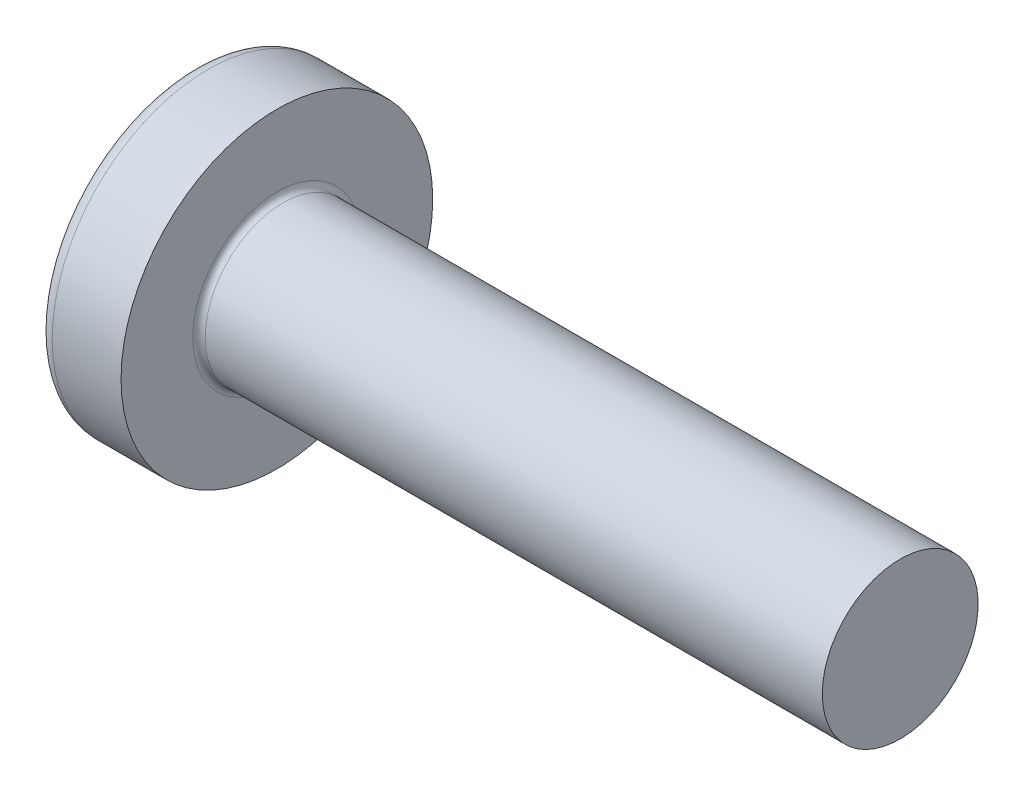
SolidWorks part; units mm, degrees
ref_plane "Plane1" through (0, 0, 0) normal (0, 0, 1) x (1, 0, 0)
ref_plane "Plane2" through (0, 0, 0) normal (0, 1, 0) x (1, 0, 0)
ref_plane "Plane3" through (0, 0, 0) normal (1, 0, 0) x (0, 0, -1)
sketch "BodySke" plane through (0, 0, 0) normal (0, 0, 1) x (1, 0, 0)
  line L0 (2.1, 1.25) -> (2.1, 2.5)
  line L1 (2.325, 6.35) -> (2.325, -3.175) construction
  line L2 (-25.4, 0) -> (127, 0) construction
  line L3 (12.1, 0) -> (0, 0)
  line L4 (2.1, 1.25) -> (12.1, 1.25)
  line L5 (12.1, 1.25) -> (12.1, 0)
  line L6 (0.995, 2.5) -> (2.1, 2.5)
  line L8 (2.1, 6.35) -> (2.1, -3.175) construction
  arc A0 (0.8032, 2.4043) -> (0, 0) centre (4, 0) ccw
  arc A2 (0.8032, 2.4043) -> (0.995, 2.5) centre (0.995, 2.26) cw
revolve "Base-Revolve" add sketch "BodySke"
fillet "Fillet1" radius 0.1 1 edges at (2.1, 0, 1.25)
sketch "Sketch3" plane through (0, 0, 0) normal (1, 0, 0) x (0, 0, -1)
  line L0 (0.37, -1.3) -> (-0.37, -1.3)
  line L1 (0.37, -1.3) -> (0.37, 1.3)
  line L2 (-0.37, 1.3) -> (0.37, 1.3)
  line L3 (-0.37, 1.3) -> (-0.37, -1.3)
ref_plane "Plane4" through (1.5, 0, 0) normal (1, 0, 0) x (0, 0, -1)
sketch "Sketch4" plane through (1.5, 0, 0) normal (1, 0, 0) x (0, 0, -1)
  line L0 (0.37, -0.5521) -> (-0.37, -0.5521)
  line L1 (0.37, -0.5521) -> (0.37, 0.5521)
  line L2 (-0.37, 0.5521) -> (0.37, 0.5521)
  line L3 (-0.37, 0.5521) -> (-0.37, -0.5521)
loft "Recess" cut profiles "Sketch3", "Sketch4"
pattern_circular "RecPat" count 2 every 90 about axis through (0, 0, 0) along (1, 0, 0) of "Recess"
sketch "RecCorSke" plane through (0, 0, 0) normal (0, 0, 1) x (1, 0, 0)
  line L0 (-3.175, 0) -> (15.875, 0) construction
  line L1 (-25.4, 0) -> (127, 0) construction
  line L2 (0, 0) -> (0, 0.6609)
  line L3 (0, 0.6609) -> (1.5, 0.556)
  line L4 (1.5, 0.556) -> (1.6807, 0)
  line L5 (1.6807, 0) -> (0, 0)
revolve "RecessCore" cut sketch "RecCorSke" angle 360 about L0
sketch "ThdSchSke" plane through (0, 0, 0) normal (0, 0, 1) x (1, 0, 0)
  line L0 (3, -0.9965) -> (2.8225, -1.25)
  line L1 (3, -0.9965) -> (3.1775, -1.25)
  line L2 (3.1775, -1.25) -> (3.1775, -1.5625)
  line L3 (-3.175, 0) -> (5.1513, 0) construction
  line L5 (3.1775, -1.5625) -> (2.8225, -1.5625)
  line L6 (2.8225, -1.5625) -> (2.8225, -1.25)
revolve "ThreadSchematic" [suppressed] cut sketch "ThdSchSke" angle 360 about L3
pattern_linear "ThdSchPat" [suppressed]
equation "\"D1@Sketch3\" = \"Cross_dia@Sketch3\" / 2"
equation "\"D2@Sketch3\" = \"Cross_width@Sketch3\" / 2"
equation "\"Depth@RecCorSke\" = \"Cross_depth@Plane4\""
equation "\"D1@Sketch4\" = \"Cross_width@Sketch3\""
equation "\"D2@Sketch4\" = \"Cross_dia@Sketch3\" - 2.0 * \"Cross_depth@Plane4\" * tan(26.5  * 0.017453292)"
equation "\"D3@Sketch4\" = \"D1@Sketch4\" / 2"
equation "\"D4@Sketch4\" = \"D2@Sketch4\" / 2"
equation "\"Thread_length@ThreadCosmetic\" = ((sgn( (\"Length@BodySke\" - \"Advance@BodySke\" * 2.0 ) - \"Thread_nom@BodySke\" )-1)*( (\"Length@BodySke\" - \"Advance@BodySke\" * 2.0 ) - \"Thread_nom@BodySke\" ))/-2+ \"Thread_"
equation "\"Thread_minor@ThdSchSke\" = \"Thread_minor@ThreadCosmetic\""
equation "\"Diameter@ThdSchSke\" = \"Diameter@BodySke\""
equation "\"Overcut@ThdSchSke\" = \"Diameter@BodySke\" * 1.25"
equation "\"Start@ThdSchSke\" = \"Head_ht@BodySke\" + \"Length@BodySke\" - \"Thread_length@ThreadCosmetic\"  '---Non-countersunk---"
equation "\"Num_threads@ThdSchPat\" = int( \"Thread_length@ThreadCosmetic\" / \"Advance@BodySke\" + 0.999 )  + 1"
equation "\"Advance@ThdSchPat\" = \"Thread_length@ThreadCosmetic\" /  (\"Num_threads@ThdSchPat\" - 1) 'relax it"
